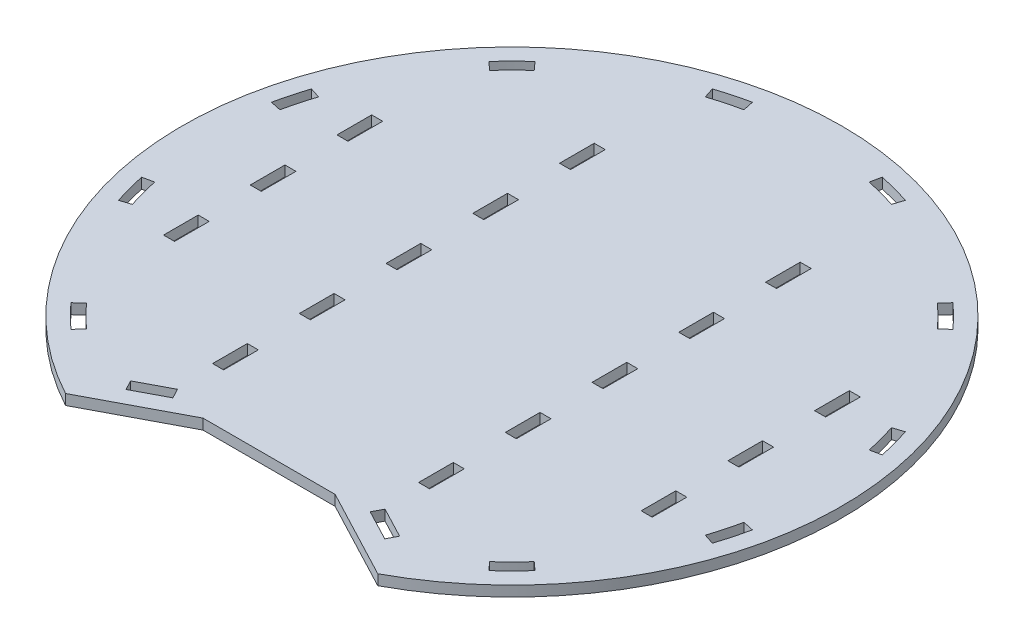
SolidWorks part; units mm, degrees
ref_plane "Front Plane" through (0, 0, 0) normal (0, 0, 1) x (1, 0, 0)
ref_plane "Top Plane" through (0, 0, 0) normal (0, 1, 0) x (1, 0, 0)
ref_plane "Right Plane" through (0, 0, 0) normal (1, 0, 0) x (0, 0, -1)
sketch "Sketch1" plane through (0, 0, 0) normal (0, 1, 0) x (1, 0, 0)
  line L0 (-106.3364, -157.4566) -> (-42.1421, -123.65) construction
  line L17 (-42.1421, -123.65) -> (42.1421, -123.65) construction
  line L18 (0, 190) -> (0, -190) construction
  line L20 (-190, 0) -> (190, 0) construction
  line L33 (140.85, -40) -> (140.85, -60)
  line L34 (-134.5, 40) -> (-140.85, 40)
  line L35 (-134.5, 40) -> (-134.5, 60)
  line L36 (-134.5, 60) -> (-140.85, 60)
  line L37 (-140.85, 40) -> (-140.85, 60)
  line L38 (-134.5, 10) -> (-140.85, 10)
  line L39 (-134.5, 10) -> (-134.5, -10)
  line L40 (-134.5, -10) -> (-140.85, -10)
  line L41 (-140.85, 10) -> (-140.85, -10)
  line L46 (-134.5, -40) -> (-140.85, -40)
  line L47 (-134.5, -40) -> (-134.5, -60)
  line L48 (-134.5, -60) -> (-140.85, -60)
  line L49 (-140.85, -40) -> (-140.85, -60)
  line L50 (134.5, -60) -> (140.85, -60)
  line L51 (134.5, -40) -> (134.5, -60)
  line L52 (134.5, -40) -> (140.85, -40)
  line L53 (140.85, 10) -> (140.85, -10)
  line L54 (134.5, -10) -> (140.85, -10)
  line L55 (134.5, 10) -> (134.5, -10)
  line L56 (134.5, 10) -> (140.85, 10)
  line L57 (140.85, 40) -> (140.85, 60)
  line L58 (134.5, 60) -> (140.85, 60)
  line L59 (134.5, 40) -> (134.5, 60)
  line L60 (134.5, 40) -> (140.85, 40)
  line L73 (42.1421, -123.65) -> (106.3364, -157.4566) construction
  line L86 (0, 0) -> (-37.4241, 176.0666) construction
  line L99 (-155.3051, -190) -> (147.1552, -190) construction
  line L100 (-128.4523, -140) -> (128.4523, -140) construction
  line L101 (-90, -167.332) -> (-38.1, -140)
  line L102 (-38.1, -140) -> (38.1, -140)
  line L103 (38.1, -140) -> (90, -167.332)
  line L104 (-53.6608, 165.151) -> (-55.6231, 171.1902)
  line L105 (0, 0) -> (-55.6231, 171.1902) construction
  line L127 (-37.4241, 176.0666) -> (-36.1039, 169.8553)
  line L128 (-100.2255, -161.4151) -> (-40.5722, -130) construction
  line L129 (-120.4435, 133.7661) -> (-116.1945, 129.0471)
  line L130 (-40.5722, -130) -> (40.5722, -130) construction
  line L131 (40.5722, -130) -> (100.2255, -161.4151) construction
  line L132 (-129.0471, 116.1945) -> (-133.7661, 120.4435)
  line L133 (-171.1902, 55.6231) -> (-165.151, 53.6608)
  line L134 (-169.8553, 36.1039) -> (-176.0666, 37.4241)
  line L135 (-176.0666, -37.4241) -> (-169.8553, -36.1039)
  line L136 (-165.151, -53.6608) -> (-171.1902, -55.6231)
  line L137 (-133.7661, -120.4435) -> (-129.0471, -116.1945)
  line L138 (-116.1945, -129.0471) -> (-120.4435, -133.7661)
  line L139 (0, 0) -> (-36.1039, 169.8553) construction
  line L140 (56.2033, -10) -> (62.5533, -10)
  line L141 (116.1945, -129.0471) -> (120.4435, -133.7661)
  line L142 (133.7661, -120.4435) -> (129.0471, -116.1945)
  line L143 (165.151, -53.6608) -> (171.1902, -55.6231)
  line L144 (176.0666, -37.4241) -> (169.8553, -36.1039)
  line L145 (169.8553, 36.1039) -> (176.0666, 37.4241)
  line L146 (171.1902, 55.6231) -> (165.151, 53.6608)
  line L147 (129.0471, 116.1945) -> (133.7661, 120.4435)
  line L148 (120.4435, 133.7661) -> (116.1945, 129.0471)
  line L149 (37.4241, 176.0666) -> (36.1039, 169.8553)
  line L150 (53.6608, 165.151) -> (55.6231, 171.1902)
  line L151 (-56.8793, -138.5878) -> (-59.8381, -132.9693)
  line L152 (-59.8381, -132.9693) -> (-77.5342, -142.2885)
  line L153 (-77.5342, -142.2885) -> (-74.5754, -147.907)
  line L154 (-74.5754, -147.907) -> (-56.8793, -138.5878)
  line L155 (77.5342, -142.2885) -> (74.5754, -147.907)
  line L156 (74.5754, -147.907) -> (56.8793, -138.5878)
  line L157 (56.8793, -138.5878) -> (59.8381, -132.9693)
  line L158 (59.8381, -132.9693) -> (77.5342, -142.2885)
  line L159 (-62.5533, 40) -> (-56.2033, 40)
  line L164 (-56.2033, 10) -> (-62.5533, 10)
  line L165 (-56.2033, 10) -> (-56.2033, -10)
  line L166 (-56.2033, -10) -> (-62.5533, -10)
  line L167 (-62.5533, 10) -> (-62.5533, -10)
  line L168 (-62.5533, 40) -> (-62.5533, 60)
  line L169 (-62.5533, 60) -> (-56.2033, 60)
  line L170 (-56.2033, 40) -> (-56.2033, 60)
  line L171 (-62.5533, 90) -> (-56.2033, 90)
  line L172 (-62.5533, 90) -> (-62.5533, 110)
  line L173 (-62.5533, 110) -> (-56.2033, 110)
  line L174 (-56.2033, 90) -> (-56.2033, 110)
  line L175 (-62.5533, -40) -> (-56.2033, -40)
  line L176 (-62.5533, -40) -> (-62.5533, -60)
  line L177 (-62.5533, -60) -> (-56.2033, -60)
  line L178 (-56.2033, -40) -> (-56.2033, -60)
  line L179 (-62.5533, -90) -> (-56.2033, -90)
  line L180 (-62.5533, -90) -> (-62.5533, -110)
  line L181 (-62.5533, -110) -> (-56.2033, -110)
  line L182 (-56.2033, -90) -> (-56.2033, -110)
  line L183 (62.5533, -60) -> (56.2033, -60)
  line L184 (56.2033, -40) -> (56.2033, -60)
  line L185 (62.5533, -40) -> (62.5533, -60)
  line L186 (62.5533, -40) -> (56.2033, -40)
  line L187 (62.5533, -110) -> (56.2033, -110)
  line L188 (62.5533, -90) -> (56.2033, -90)
  line L189 (56.2033, -90) -> (56.2033, -110)
  line L190 (62.5533, -90) -> (62.5533, -110)
  line L191 (56.2033, 90) -> (56.2033, 110)
  line L192 (62.5533, 110) -> (56.2033, 110)
  line L193 (62.5533, 90) -> (62.5533, 110)
  line L194 (62.5533, 90) -> (56.2033, 90)
  line L195 (56.2033, 40) -> (56.2033, 60)
  line L196 (62.5533, 60) -> (56.2033, 60)
  line L197 (62.5533, 40) -> (62.5533, 60)
  line L198 (62.5533, 10) -> (62.5533, -10)
  line L199 (56.2033, 10) -> (56.2033, -10)
  line L200 (56.2033, 10) -> (62.5533, 10)
  line L201 (62.5533, 40) -> (56.2033, 40)
  circle A0 centre (0, 0) radius 190 construction
  arc A3 (-90, -167.332) -> (90, -167.332) centre (0, 0) cw
  circle A16 centre (0, 0) radius 180 construction
  circle A17 centre (0, 0) radius 173.65 construction
  arc A18 (-55.6231, 171.1902) -> (-37.4241, 176.0666) centre (0, 0) cw
  arc A19 (-53.6608, 165.151) -> (-36.1039, 169.8553) centre (0, 0) cw
  arc A20 (-133.7661, 120.4435) -> (-120.4435, 133.7661) centre (0, 0) cw
  arc A21 (-129.0471, 116.1945) -> (-116.1945, 129.0471) centre (0, 0) cw
  arc A22 (-176.0666, 37.4241) -> (-171.1902, 55.6231) centre (0, 0) cw
  arc A23 (-169.8553, 36.1039) -> (-165.151, 53.6608) centre (0, 0) cw
  arc A24 (-171.1902, -55.6231) -> (-176.0666, -37.4241) centre (0, 0) cw
  arc A25 (-165.151, -53.6608) -> (-169.8553, -36.1039) centre (0, 0) cw
  arc A26 (-120.4435, -133.7661) -> (-133.7661, -120.4435) centre (0, 0) cw
  arc A27 (-116.1945, -129.0471) -> (-129.0471, -116.1945) centre (0, 0) cw
  arc A28 (120.4435, -133.7661) -> (133.7661, -120.4435) centre (0, 0) ccw
  arc A29 (116.1945, -129.0471) -> (129.0471, -116.1945) centre (0, 0) ccw
  arc A30 (165.151, -53.6608) -> (169.8553, -36.1039) centre (0, 0) ccw
  arc A31 (171.1902, -55.6231) -> (176.0666, -37.4241) centre (0, 0) ccw
  arc A32 (176.0666, 37.4241) -> (171.1902, 55.6231) centre (0, 0) ccw
  arc A33 (169.8553, 36.1039) -> (165.151, 53.6608) centre (0, 0) ccw
  arc A34 (133.7661, 120.4435) -> (120.4435, 133.7661) centre (0, 0) ccw
  arc A35 (129.0471, 116.1945) -> (116.1945, 129.0471) centre (0, 0) ccw
  arc A36 (53.6608, 165.151) -> (36.1039, 169.8553) centre (0, 0) ccw
  arc A37 (55.6231, 171.1902) -> (37.4241, 176.0666) centre (0, 0) ccw
  point P71 (-59.3783, 90)
  point P116 (0, -140)
  point P199 (-56.2033, 0)
  dimension "D1" = 380
  dimension "D30" = 360
  dimension "D31" = 347.3
  dimension "D38" = 20
  dimension "D6" = 6.35
  dimension "D7" = 71.9467
  dimension "D8" = 20
  dimension "D9" = 30
  dimension "D10" = 30
  dimension "D11" = 30
  dimension "D16" = 6.35
  dimension "D17" = 50
  dimension "D18" = 76.2
  dimension "D19" = 6.35
  dimension "D20" = 6.35
  dimension "D21" = 30
  dimension "D22" = 30
  dimension "D28" = 6
  dimension "D29" = 12
  dimension "D32" = 10
  dimension "D33" = 10
  dimension "D34" = 10
  dimension "D35" = 5
  dimension "D39" = 20
  dimension "D41" = 20
extrude "Boss-Extrude1" add sketch "Sketch1" along normal blind 6
